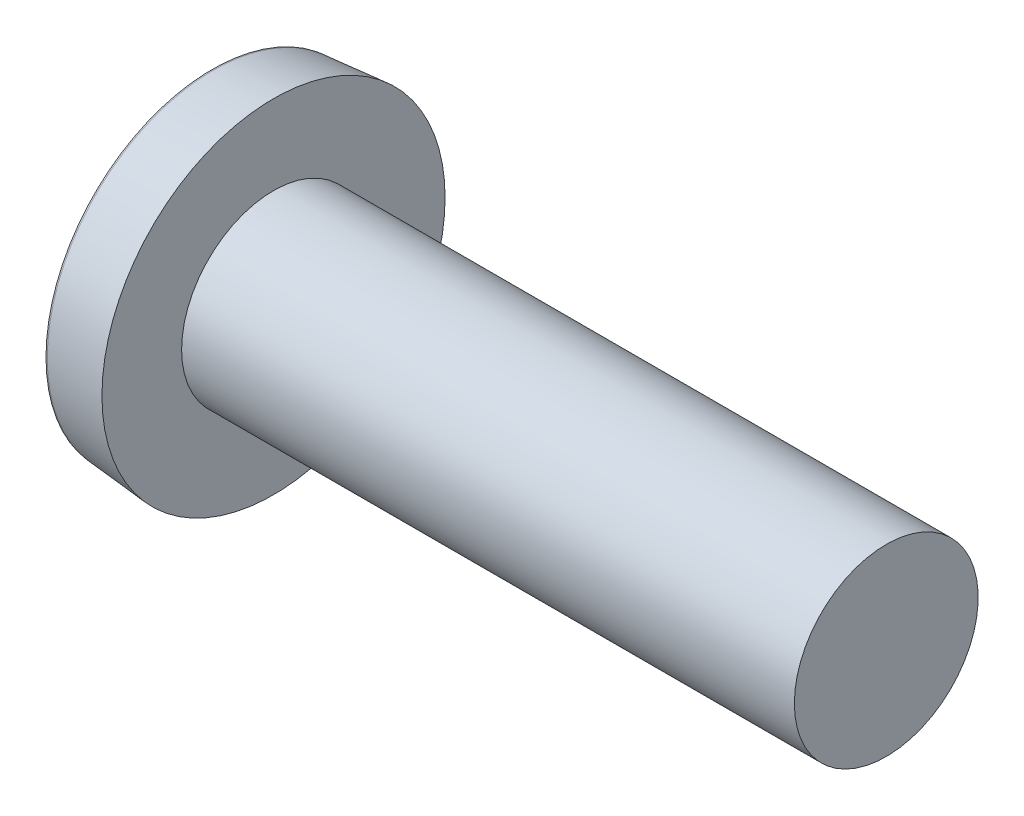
SolidWorks part; units mm, degrees
ref_plane "Plane1" through (0, 0, 0) normal (0, 0, 1) x (1, 0, 0)
ref_plane "Plane2" through (0, 0, 0) normal (0, 1, 0) x (1, 0, 0)
ref_plane "Plane3" through (0, 0, 0) normal (1, 0, 0) x (0, 0, -1)
sketch "BodySke" plane through (0, 0, 0) normal (0, 0, 1) x (1, 0, 0)
  line L0 (1.8, 1.5) -> (1.8, 2.8)
  line L1 (0, 0) -> (0, 2.6425)
  line L2 (-25.4, 0) -> (127, 0) construction
  line L3 (11.8, 0) -> (0, 0)
  line L4 (1.8, 1.5) -> (11.8, 1.5)
  line L5 (11.8, 1.5) -> (11.8, 0)
  line L6 (0, 2.6425) -> (1.8, 2.8)
  line L9 (2.3, 3.0875) -> (2.3, -6.4375) construction
  line L10 (1.8, 6.35) -> (1.8, -3.175) construction
  dimension "Head_ht" = 1.8
  dimension "Diameter" = 3
  dimension "Length" = 10
  dimension "Head_dia" = 5.6
  dimension "Advance" = 0.5
  dimension "Thread_nom" = 10
  dimension "Head_side_angle" = 5
revolve "Base-Revolve" add sketch "BodySke"
fillet "Fillet1" [suppressed] radius 0.1
fillet "Fillet2" radius 0.9 1 edges at (0, 0, 2.6425)
sketch "Sketch2" plane through (0, 0, 0) normal (1, 0, 0) x (0, 0, -1)
  line L0 (2.8, -0.4) -> (-2.8, -0.4)
  line L1 (2.8, -0.4) -> (2.8, 0.4)
  line L2 (-2.8, 0.4) -> (2.8, 0.4)
  line L3 (-2.8, 0.4) -> (-2.8, -0.4)
  dimension "D1" = 5.6
  dimension "D2" = 2.8
  dimension "Slot_width" = 0.8
  dimension "D3" = 0.4
extrude "Slot" cut sketch "Sketch2" along normal blind 0.7
sketch "ThdSchSke" plane through (0, 0, 0) normal (0, 0, 1) x (1, 0, 0)
  line L0 (2.8, -1.2195) -> (2.6036, -1.5)
  line L1 (2.8, -1.2195) -> (2.9964, -1.5)
  line L2 (2.9964, -1.5) -> (2.9964, -1.875)
  line L3 (-3.175, 0) -> (5.1513, 0) construction
  line L5 (2.9964, -1.875) -> (2.6036, -1.875)
  line L6 (2.6036, -1.875) -> (2.6036, -1.5)
  dimension "Thread_minor" = 2.439
  dimension "Diameter" = 3
  dimension "Start" = 2.8
  dimension "SideAngle" = 55
  dimension "VeeAngle" = 70
  dimension "Overcut" = 3.75
revolve "ThreadSchematic" [suppressed] cut sketch "ThdSchSke" angle 360 about L3
pattern_linear "ThdSchPat" [suppressed]
sketch "Sketch3" plane through (0, 0, 0) normal (0, 1, 0) x (1, 0, 0)
  line L1 (-0.9312, 3.6228) -> (0.7991, 3.6228)
  line L2 (-0.9312, 3.6228) -> (-0.9312, -3.5547)
  line L3 (-0.9312, -3.5547) -> (0.7991, -3.5547)
  line L4 (0.7991, 3.6228) -> (0.7991, -3.5547)
extrude "Extrude1" cut sketch "Sketch3" against normal mid plane 10
equation "\"D1@Sketch2\" = \"Head_dia@BodySke\""
equation "\"D2@Sketch2\" = \"D1@Sketch2\" / 2"
equation "\"D3@Sketch2\" = \"Slot_width@Sketch2\" / 2"
equation "\"Thread_length@ThreadCosmetic\" = ((sgn( (\"Length@BodySke\" - \"Advance@BodySke\" * 2.0 ) - \"Thread_nom@BodySke\" )-1)*( (\"Length@BodySke\" - \"Advance@BodySke\"  * 2.0) - \"Thread_nom@BodySke\" ))/-2+ \"Thread_"
equation "\"Thread_minor@ThdSchSke\" = \"Thread_minor@ThreadCosmetic\""
equation "\"Diameter@ThdSchSke\" = \"Diameter@BodySke\""
equation "\"Overcut@ThdSchSke\" = \"Diameter@BodySke\" * 1.25"
equation "\"Start@ThdSchSke\" = \"Head_ht@BodySke\" + \"Length@BodySke\" - \"Thread_length@ThreadCosmetic\"  '---Non-countersunk---"
equation "\"Num_threads@ThdSchPat\" = int( \"Thread_length@ThreadCosmetic\" / \"Advance@BodySke\" + 0.999 )  + 1"
equation "\"Advance@ThdSchPat\" = \"Thread_length@ThreadCosmetic\" /  (\"Num_threads@ThdSchPat\" - 1) 'relax it"
